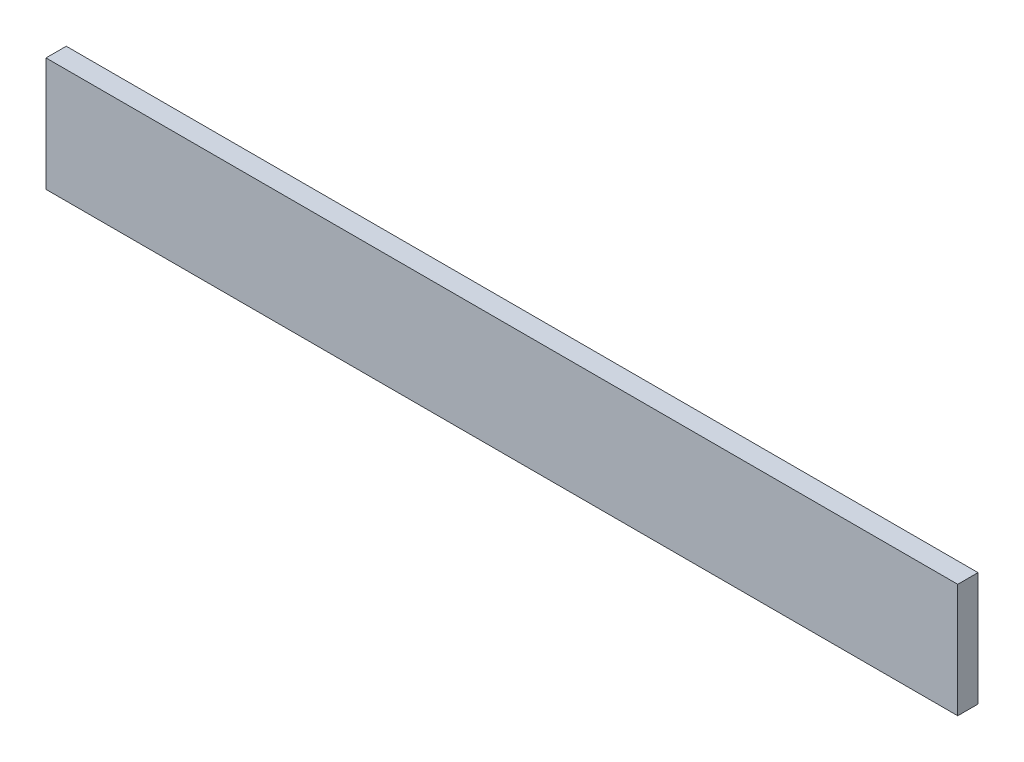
SolidWorks part; units mm, degrees
ref_plane "Front Plane" through (0, 0, 0) normal (0, 0, 1) x (1, 0, 0)
ref_plane "Top Plane" through (0, 0, 0) normal (0, 1, 0) x (1, 0, 0)
ref_plane "Right Plane" through (0, 0, 0) normal (1, 0, 0) x (0, 0, -1)
sketch "Sketch1" plane through (0, 0, 0) normal (0, 0, 1) x (1, 0, 0)
  line L1 (285.75, 35.687) -> (-285.75, 35.687)
  line L2 (285.75, 35.687) -> (285.75, -35.687)
  line L3 (285.75, -35.687) -> (-285.75, -35.687)
  line L4 (-285.75, 35.687) -> (-285.75, -35.687)
  line L5 (285.75, 35.687) -> (-285.75, -35.687) construction
  line L6 (285.75, -35.687) -> (-285.75, 35.687) construction
  point P0 (0, 0)
  dimension "D1" = 571.5
  dimension "D2" = 71.374
extrude "Boss-Extrude1" add sketch "Sketch1" along normal blind 12.7
